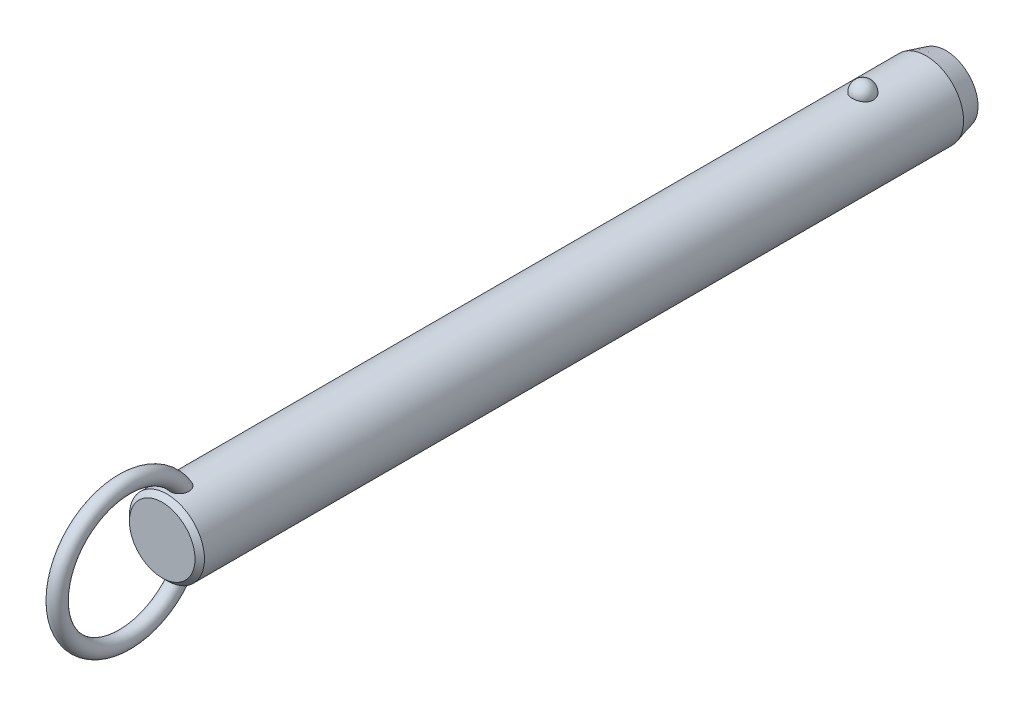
SolidWorks part; units mm, degrees
ref_plane "Front Plane" through (0, 0, 0) normal (0, 0, 1) x (1, 0, 0)
ref_plane "Top Plane" through (0, 0, 0) normal (0, 1, 0) x (1, 0, 0)
ref_plane "Right Plane" through (0, 0, 0) normal (1, 0, 0) x (0, 0, -1)
sketch "Sketch2" plane through (0, 0, 0) normal (0, 0, 1) x (1, 0, 0)
  circle A0 centre (0, 0) radius 9.5
  point P3 (0, 9.5)
  dimension "D1" = 19
extrude "Boss-Extrude1" add sketch "Sketch2" along normal blind 165.1
sketch "Sketch3" plane through (0, 0, 0) normal (0, 0, -1) x (-1, 0, 0)
  circle A0 centre (0, 0) radius 9.5
  dimension "D1" = 19
extrude "Boss-Extrude2" add sketch "Sketch3" along normal blind 23.7
chamfer "Chamfer1" distance 5 angle 15 1 edges at (-9.5, 0, -23.7)
sketch "Sketch12" plane through (0, 0, 0) normal (1, 0, 0) x (0, 0, -1)
  line L0 (-165.1, 9.5) -> (-165.1, -9.5) construction
  point P0 (-165.1, 0)
sketch "Sketch13" plane through (0, 0, 0) normal (1, 0, 0) x (0, 0, -1)
  circle A0 centre (-184.15, 0) radius 19.05
  point P2 (-165.1, 0)
  dimension "D1" = 38.1
sketch "Sketch14" plane through (0, 0, 0) normal (0, 1, 0) x (1, 0, 0)
  circle A0 centre (0, -167.1) radius 2
  point P2 (0, -165.1)
  dimension "D1" = 4
sweep "Sweep1" add profiles "Sketch14" path "Sketch13"
sketch "Sketch15" plane through (0, 0, 165.1) normal (0, 0, 1) x (1, 0, 0)
  circle A0 centre (0, 0) radius 9.5
  dimension "D1" = 19
extrude "Boss-Extrude3" add sketch "Sketch15" along normal blind 9.52
chamfer "Chamfer2" distance 1.2 angle 45 1 edges at (9.5, 0, 174.62)
sketch "Sketch18" plane through (0, 0, 0) normal (1, 0, 0) x (0, 0, -1)
  line L0 (18.7, 9.5) -> (-167.6378, 9.5) construction
  line L1 (2.7, 12.2) -> (2.7, 6.8)
  line L2 (-167.6378, -9.5) -> (18.7, -9.5) construction
  arc A0 (2.7, 12.2) -> (2.7, 6.8) centre (2.7, 9.5) ccw
  point P4 (0, 9.5)
  dimension "D1" = 21.7
revolve "Revolve1" add sketch "Sketch18" angle 360 about L1
